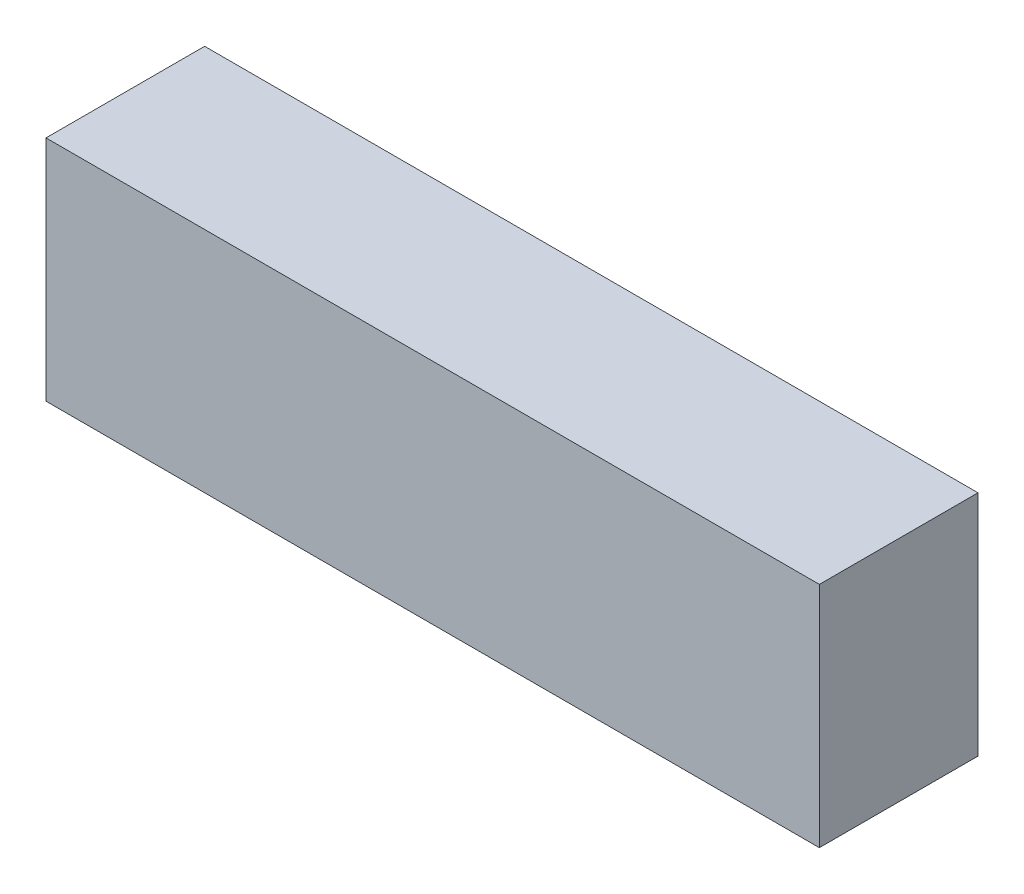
SolidWorks part; units mm, degrees
ref_plane "Plano frontal" through (0, 0, 0) normal (0, 0, 1) x (1, 0, 0)
ref_plane "Plano superior" through (0, 0, 0) normal (0, 1, 0) x (1, 0, 0)
ref_plane "Plano direito" through (0, 0, 0) normal (1, 0, 0) x (0, 0, -1)
sketch "Esboço1" plane through (0, 0, 0) normal (0, 1, 0) x (1, 0, 0)
  line L1 (-78, -16) -> (78, -16)
  line L2 (-78, -16) -> (-78, 16)
  line L3 (-78, 16) -> (78, 16)
  line L4 (78, -16) -> (78, 16)
  line L5 (-78, -16) -> (78, 16) construction
  line L6 (-78, 16) -> (78, -16) construction
  point P0 (0, 0)
  dimension "D1" = 156
  dimension "D2" = 32
extrude "Extrusão1" add sketch "Esboço1" along normal blind 46
